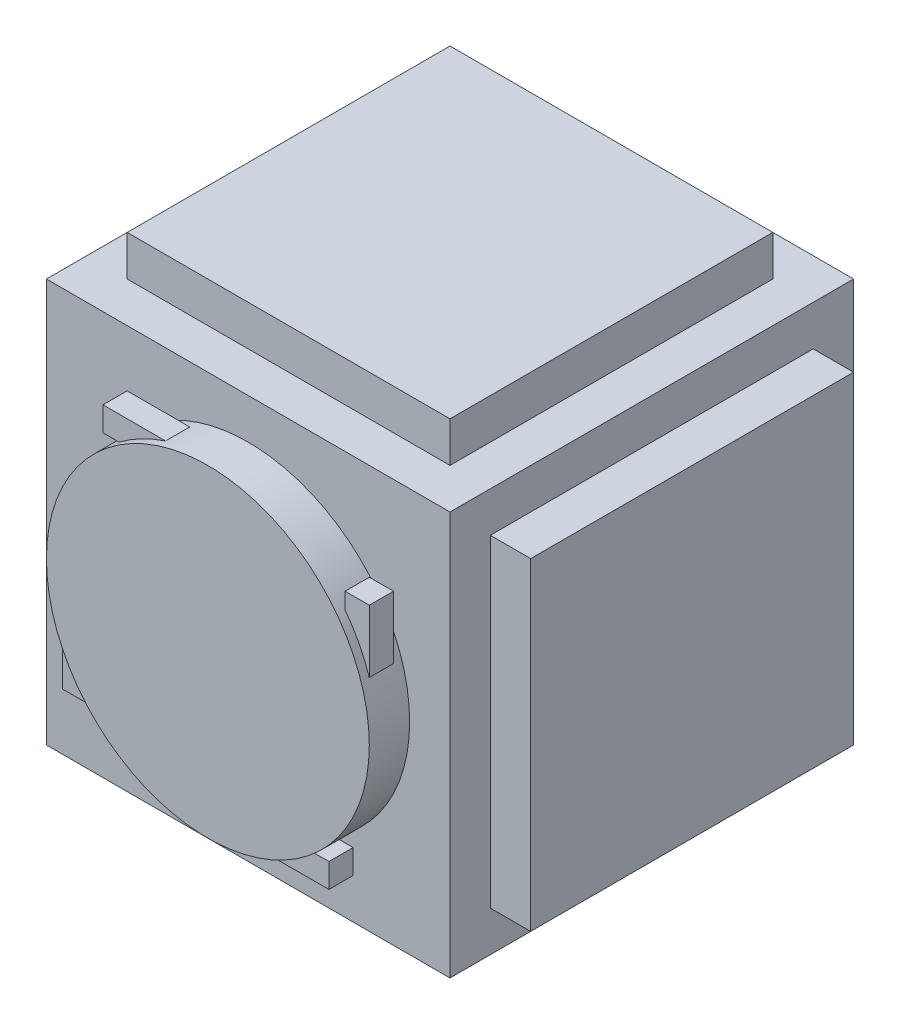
SolidWorks part; units mm, degrees
ref_plane "Front Plane" through (0, 0, 0) normal (0, 0, 1) x (1, 0, 0)
ref_plane "Top Plane" through (0, 0, 0) normal (0, 1, 0) x (1, 0, 0)
ref_plane "Right Plane" through (0, 0, 0) normal (1, 0, 0) x (0, 0, -1)
sketch "Sketch1" plane through (0, 0, 0) normal (0, 0, 1) x (1, 0, 0)
  line L1 (0, 0) -> (250, 0)
  line L2 (0, 0) -> (0, 250)
  line L3 (0, 250) -> (250, 250)
  line L4 (250, 0) -> (250, 250)
  dimension "D1" = 250
  dimension "D2" = 250
extrude "Boss-Extrude1" add sketch "Sketch1" along normal blind 250
sketch "Sketch2" plane through (0, 250, 0) normal (0, 1, 0) x (1, 0, 0)
  line L0 (0, -250) -> (0, 0) construction
  line L1 (25, -225) -> (225, -225)
  line L2 (25, -225) -> (25, -25)
  line L3 (25, -25) -> (225, -25)
  line L4 (225, -225) -> (225, -25)
  line L5 (250, 0) -> (0, 0) construction
  dimension "D1" = 200
  dimension "D2" = 200
  dimension "D3" = 25
  dimension "D4" = 25
extrude "Boss-Extrude2" add sketch "Sketch2" along normal blind 25
pattern_circular "CirPattern1" count 4 over 360 about axis through (125, 125, 0) along (0, 0, 1) of "Boss-Extrude2"
ref_plane "Plane1" through (0, 125, 0) normal (0, 1, 0) x (1, 0, 0)
sketch "Sketch5" plane through (0, 125, 0) normal (0, 1, 0) x (1, 0, 0)
  line L0 (250, -250) -> (0, -250) construction
  line L1 (125, -250) -> (225, -250)
  line L2 (125, -250) -> (125, -275)
  line L3 (125, -275) -> (225, -275)
  line L4 (225, -250) -> (225, -275)
  dimension "D1" = 100
  dimension "D2" = 25
revolve "Revolve1" add sketch "Sketch5" angle 360 about L2
sketch "Sketch6" plane through (0, 125, 0) normal (0, 1, 0) x (1, 0, 0)
  line L0 (25, -275) -> (225, -275) construction
  line L1 (220, -255) -> (205, -255)
  line L2 (220, -255) -> (220, -270)
  line L3 (220, -270) -> (205, -270)
  line L4 (205, -255) -> (205, -270)
  line L5 (225, -275) -> (225, -250) construction
  dimension "D1" = 15
  dimension "D2" = 15
  dimension "D3" = 5
  dimension "D4" = 5
extrude "Boss-Extrude4" add sketch "Sketch6" along normal blind 70
pattern_circular "CirPattern2" count 4 every 90 about axis through (125, 125, 0) along (0, 0, 1) of "Boss-Extrude4"
scale "Scale1" scale about centroid uniform scaling yes scale factor 0.5
